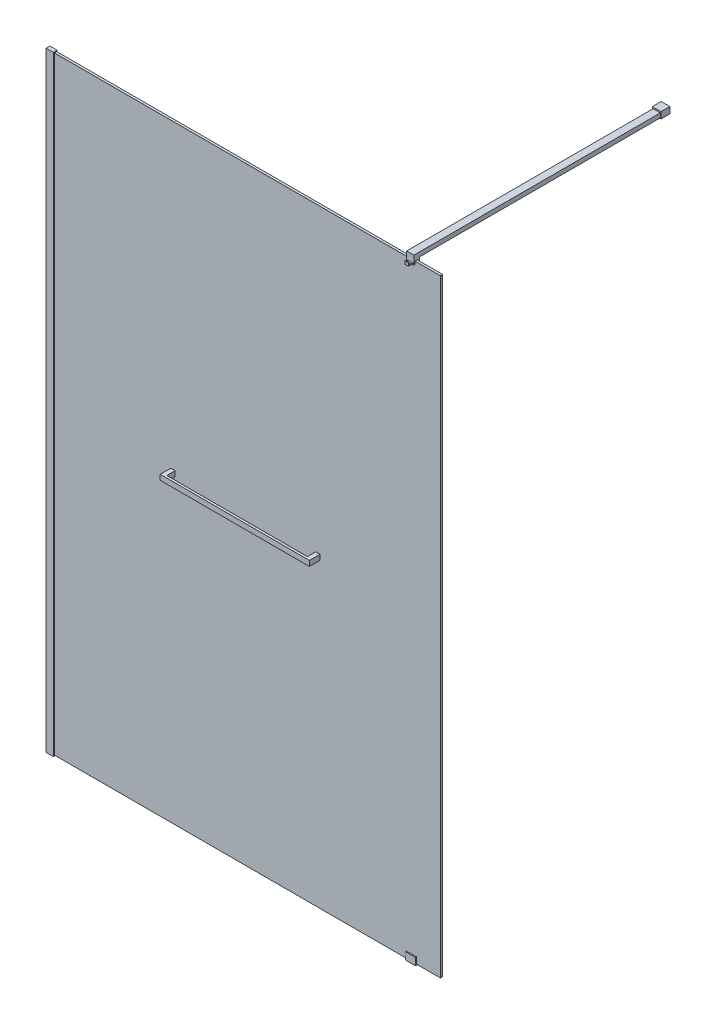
SolidWorks part; units mm, degrees
ref_plane "Płaszczyzna przednia" through (0, 0, 0) normal (0, 0, 1) x (1, 0, 0)
ref_plane "Płaszczyzna górna" through (0, 0, 0) normal (0, 1, 0) x (1, 0, 0)
ref_plane "Płaszczyzna prawa" through (0, 0, 0) normal (1, 0, 0) x (0, 0, -1)
sketch "Szkic1" plane through (0, 0, 0) normal (0, 1, 0) x (1, 0, 0)
  line L0 (0, 0) -> (0, 13.3)
  line L2 (0, 13.3) -> (25, 13.3)
  line L3 (25, 13.3) -> (25, 11.4)
  line L4 (25, 11.4) -> (11.45, 11.4)
  line L5 (11.45, 11.4) -> (11.45, 3.4)
  line L6 (11.45, 3.4) -> (25, 3.4)
  line L7 (25, 3.4) -> (25, 0)
  line L8 (25, 0) -> (0, 0)
  dimension "D1" = 13.3
  dimension "D4" = 1.9
  dimension "D5" = 8
  dimension "D6" = 3.4
  dimension "D7" = 13.55
  dimension "D8" = 25
extrude "Dodanie-wyciągnięcie1" add sketch "Szkic1" along normal blind 2100
sketch "Szkic2" plane through (0, 0, 0) normal (0, -1, 0) x (1, 0, 0)
  line L0 (11.45, -3.4) -> (1358.45, -3.4)
  line L1 (11.45, -3.4) -> (11.45, -11.4)
  line L2 (1358.45, -3.4) -> (1358.45, -11.4)
  line L3 (11.45, -11.4) -> (1358.45, -11.4)
  line L4 (11.45, -11.4) -> (25, -11.4) construction
  dimension "D1" = 1347
extrude "Dodanie-wyciągnięcie2" add sketch "Szkic2" against normal blind 2100 separate body
sketch "Szkic4" plane through (0, 2100, 0) normal (0, 1, 0) x (1, 0, 0)
  line L1 (25, 13.3) -> (0, 13.3) construction
  line L2 (25, 11.4) -> (25, 13.3) construction
  line L3 (0, 13.3) -> (0, 0) construction
  line L5 (0, 0) -> (25, 0) construction
  line L7 (25, 13.3) -> (0, 13.3)
  line L8 (25, 0) -> (25, 13.3)
  line L9 (0, 13.3) -> (0, 0)
  line L11 (0, 0) -> (25, 0)
extrude "Dodanie-wyciągnięcie3" add sketch "Szkic4" along normal blind 3
sketch "Szkic5" plane through (0, 0, 0) normal (0, -1, 0) x (1, 0, 0)
  line L1 (0, 0) -> (25, 0) construction
  line L2 (25, 0) -> (25, -3.4) construction
  line L3 (0, -13.3) -> (0, 0) construction
  line L5 (25, -13.3) -> (0, -13.3) construction
  line L7 (0, 0) -> (25, 0)
  line L8 (25, 0) -> (25, -13.3)
  line L9 (0, -13.3) -> (0, 0)
  line L11 (25, -13.3) -> (0, -13.3)
extrude "Dodanie-wyciągnięcie4" add sketch "Szkic5" along normal blind 3
ref_plane "Płaszczyzna1" through (1258.45, 0, 0) normal (1, 0, 0) x (0, 0, -1)
sketch "Szkic6" plane through (1258.45, 0, 0) normal (1, 0, 0) x (0, 0, -1)
  line L0 (11.4, 22) -> (15.75, 22)
  line L1 (15.75, 22) -> (15.75, -3)
  line L2 (15.75, -3) -> (-0.35, -3)
  line L3 (-0.35, -3) -> (-0.35, 22)
  line L4 (-0.35, 22) -> (3.4, 22)
  line L5 (11.4, 22) -> (11.4, 0)
  line L6 (11.4, 0) -> (11.4, 2100)
  line L7 (11.4, 0) -> (11.4, 2100) construction
  line L8 (3.4, 2100) -> (3.4, 0)
  line L9 (3.4, 2100) -> (3.4, 0) construction
  line L10 (11.4, 0) -> (3.4, 0)
  line L11 (3.4, 0) -> (3.4, 22)
  dimension "D1" = 4.35
  dimension "D2" = 25
  dimension "D3" = 3
  dimension "D4" = 3.75
extrude "Dodanie-wyciągnięcie5" add sketch "Szkic6" along normal mid plane 35 separate body
sketch "Szkic7" plane through (1258.45, 0, 0) normal (1, 0, 0) x (0, 0, -1)
  line L0 (3.4, 2100) -> (3.4, 0) construction
  line L1 (-0.6, 2120) -> (19.4, 2120)
  line L2 (3.4, 2100) -> (3.4, 0) construction
  line L4 (11.4, 2100) -> (3.4, 2100) construction
  line L13 (11.4, 2100) -> (11.4, 0) construction
  line L20 (19.4, 2120) -> (19.4, 2090)
  line L25 (19.4, 2090) -> (11.4, 2090)
  line L26 (11.4, 2090) -> (11.4, 2100)
  line L27 (11.4, 2100) -> (3.4, 2100)
  line L28 (3.4, 2100) -> (3.4, 2090)
  line L29 (3.4, 2090) -> (-13.37, 2090)
  line L30 (-13.37, 2090) -> (-13.37, 2100)
  line L31 (-13.37, 2100) -> (-10.37, 2100)
  line L32 (-10.37, 2100) -> (-9.8451, 2094)
  line L33 (-9.8451, 2094) -> (-0.6, 2094)
  line L34 (-0.6, 2094) -> (-0.6, 2120)
  dimension "D3" = 20
  dimension "D4" = 30
  dimension "D5" = 16.77
  dimension "D6" = 4
  dimension "D14" = 8
  dimension "D21" = 10
  dimension "D22" = 4
  dimension "D23" = 3
  dimension "D24" = 95
extrude "Dodanie-wyciągnięcie6" add sketch "Szkic7" along normal mid plane 25 separate body
sketch "Szkic8" plane through (0, 2100, 0) normal (0, 1, 0) x (1, 0, 0)
  line L0 (1245.95, -0.6) -> (1252.45, -3.631)
  line L1 (1252.45, -3.631) -> (1252.45, -13.37)
  line L2 (1270.95, -0.6) -> (1264.45, -3.631)
  line L3 (1264.45, -3.631) -> (1264.45, -13.37)
  line L4 (1258.45, -10.37) -> (1258.45, 156.6902) construction
  line L5 (1270.95, -10.37) -> (1245.95, -10.37) construction
  line L6 (1252.45, -13.37) -> (1264.45, -13.37)
  line L7 (1270.95, -13.37) -> (1245.95, -13.37) construction
  dimension "D1" = 12
  dimension "D2" = 115
extrude "Wytnij-wyciągnięcie1" cut sketch "Szkic8" against normal through all and the other way through all
sketch "Szkic10" plane through (0, 2120, 0) normal (0, 1, 0) x (1, 0, 0)
  line L0 (1258.45, 31.9) -> (1258.45, 19.4) construction
  line L1 (1245.95, 881.03) -> (1270.95, 881.03)
  line L2 (1245.95, 881.03) -> (1245.95, 19.4)
  line L3 (1245.95, 19.4) -> (1270.95, 19.4)
  line L4 (1270.95, 19.4) -> (1245.95, 19.4) construction
  line L5 (1245.95, 19.4) -> (1245.95, -0.6) construction
  line L6 (1270.95, 881.03) -> (1270.95, 19.4)
  point P4 (1258.45, 31.9)
  dimension "D2" = 861.63
  dimension "D1" = 25
  dimension "D3" = 12.5
extrude "Dodanie-wyciągnięcie7" add sketch "Szkic10" against normal blind 15
sketch "Szkic14" plane through (0, 0, -881.03) normal (0, 0, -1) x (-1, 0, 0)
  line L1 (-1273.45, 2125) -> (-1243.45, 2125)
  line L2 (-1273.45, 2125) -> (-1273.45, 2103)
  line L3 (-1273.45, 2103) -> (-1243.45, 2103)
  line L4 (-1243.45, 2125) -> (-1243.45, 2103)
  line L5 (-1273.45, 2125) -> (-1243.45, 2103) construction
  line L6 (-1273.45, 2103) -> (-1243.45, 2125) construction
  line L7 (-1258.45, 2120) -> (-1258.45, 2114) construction
  line L8 (-1270.95, 2120) -> (-1245.95, 2120) construction
  line L9 (-1270.95, 2105) -> (-1245.95, 2105) construction
  point P0 (-1258.45, 2114)
  dimension "D1" = 30
  dimension "D2" = 22
  dimension "D3" = 2
extrude "Dodanie-wyciągnięcie8" add sketch "Szkic14" against normal blind 31
sketch "Szkic17" plane through (0, 0, -3.4) normal (0, 0, 1) x (1, 0, 0)
  line L0 (684.95, 2100) -> (684.95, 1050) construction
  line L1 (1358.45, 2100) -> (11.45, 2100) construction
  line L2 (684.95, 1050) -> (684.95, 0) construction
  line L3 (1358.45, 0) -> (11.45, 0) construction
  line L4 (434.95, 1050) -> (934.95, 1050) construction
  line L6 (427.45, 1059) -> (442.45, 1059)
  line L7 (427.45, 1059) -> (427.45, 1041)
  line L8 (427.45, 1041) -> (442.45, 1041)
  line L9 (442.45, 1059) -> (442.45, 1041)
  line L10 (427.45, 1059) -> (442.45, 1041) construction
  line L11 (427.45, 1041) -> (442.45, 1059) construction
  line L12 (927.45, 1059) -> (942.45, 1059)
  line L13 (927.45, 1059) -> (927.45, 1041)
  line L14 (927.45, 1041) -> (942.45, 1041)
  line L15 (942.45, 1059) -> (942.45, 1041)
  line L16 (927.45, 1059) -> (942.45, 1041) construction
  line L17 (927.45, 1041) -> (942.45, 1059) construction
  dimension "D1" = 500
  dimension "D2" = 15
  dimension "D3" = 18
extrude "polka_1a" add sketch "Szkic17" along normal blind 36.5 and the other way blind 31 separate body
sketch "Szkic18" plane through (427.45, 0, 0) normal (-1, 0, 0) x (0, 0, 1)
  line L0 (-34.4, 1059) -> (-34.4, 1041) construction
  line L1 (-34.4, 1053.73) -> (-21.6, 1053.73)
  line L2 (-34.4, 1053.73) -> (-34.4, 1045.73)
  line L3 (-34.4, 1045.73) -> (-21.6, 1045.73)
  line L4 (-21.6, 1053.73) -> (-21.6, 1045.73)
  line L5 (-34.4, 1041) -> (33.1, 1041) construction
  dimension "D1" = 4.73
  dimension "D2" = 8
  dimension "D3" = 12.8
extrude "polka_1b" cut sketch "Szkic18" against normal up to surface (515 mm away)
sketch "Szkic19" plane through (0, 1059, 0) normal (0, 1, 0) x (1, 0, 0)
  line L0 (942.45, 21.6) -> (427.45, 21.6)
  line L1 (942.45, 21.6) -> (942.45, 101.6)
  line L2 (427.45, 21.6) -> (427.45, 101.6)
  line L3 (942.45, 101.6) -> (427.45, 101.6)
  line L4 (942.45, 34.4) -> (942.45, -33.1) construction
  line L5 (427.45, 34.4) -> (427.45, -33.1) construction
  line L6 (11.45, 11.4) -> (1358.45, 11.4) construction
  dimension "D1" = 10.2
  dimension "D2" = 80
extrude "polka_1c" add sketch "Szkic19" against normal blind 8 from offset 5.28 separate body
sketch "Szkic20" plane through (442.45, 0, 0) normal (1, 0, 0) x (0, 0, -1)
  line L0 (34.4, 1041) -> (-33.1, 1041) construction
  line L1 (-33.1, 1059) -> (-25.1, 1059)
  line L2 (-33.1, 1059) -> (-33.1, 1041)
  line L3 (-33.1, 1041) -> (-25.1, 1041)
  line L4 (-25.1, 1059) -> (-25.1, 1041)
  dimension "D1" = 8
extrude "polka_1d" add sketch "Szkic20" along normal up to surface (485 mm away)
